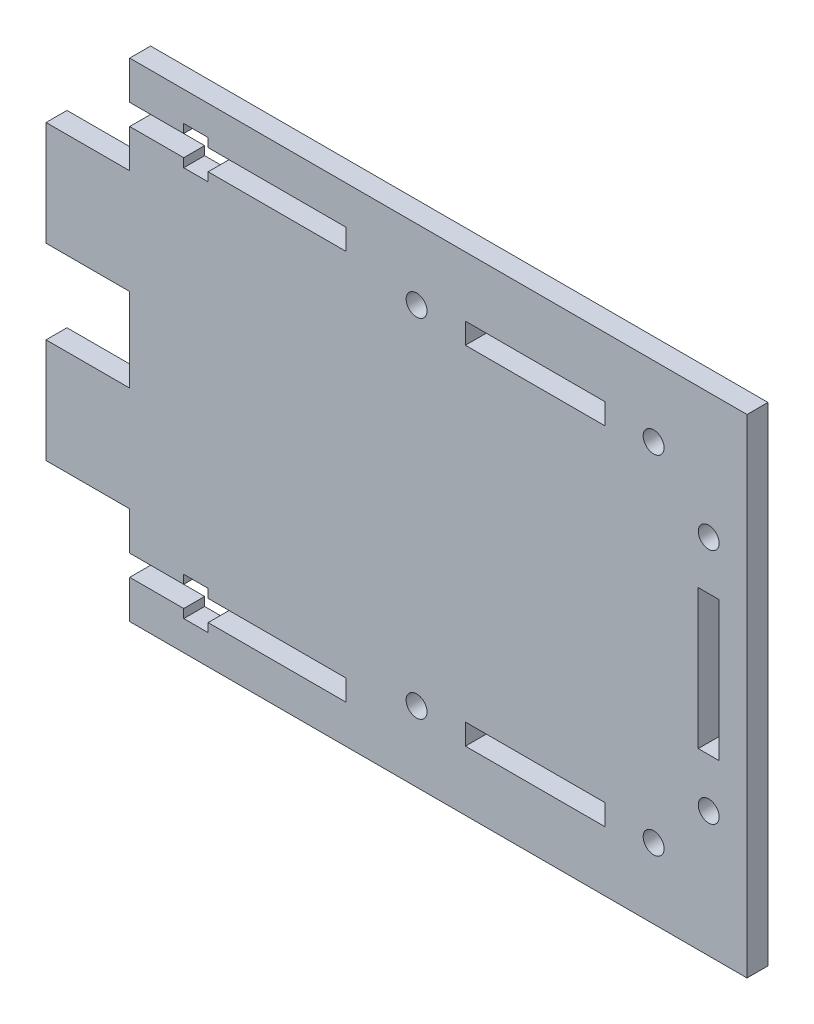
SolidWorks part; units mm, degrees
ref_plane "Front Plane" through (0, 0, 0) normal (0, 0, 1) x (1, 0, 0)
ref_plane "Top Plane" through (0, 0, 0) normal (0, 1, 0) x (1, 0, 0)
ref_plane "Right Plane" through (0, 0, 0) normal (1, 0, 0) x (0, 0, -1)
sketch "Sketch1" plane through (0, 0, 0) normal (0, 0, 1) x (1, 0, 0)
  line L0 (-1050.275, 28) -> (48949.725, 28) construction
  line L1 (-50.275, 6) -> (-38.275, 6)
  line L2 (-50.275, 6) -> (-50.275, 21)
  line L3 (-50.275, 21) -> (-38.275, 21)
  line L4 (-38.275, 6) -> (-38.275, 21)
  line L5 (-50.275, -6) -> (-38.275, -6)
  line L6 (-50.275, -6) -> (-50.275, -21)
  line L7 (-50.275, -21) -> (-38.275, -21)
  line L8 (-38.275, -6) -> (-38.275, -21)
  line L9 (-1050.275, -28) -> (48949.725, -28) construction
  line L10 (-50.275, 26.5) -> (-7.275, 26.5)
  line L11 (-50.275, 26.5) -> (-50.275, 29.5)
  line L12 (-50.275, 29.5) -> (-7.275, 29.5)
  line L13 (-7.275, 26.5) -> (-7.275, 29.5)
  line L14 (-50.275, 26.5) -> (-7.275, 29.5) construction
  line L15 (-50.275, 29.5) -> (-7.275, 26.5) construction
  line L16 (44.775, -997.1212) -> (44.775, 49002.8788) construction
  line L17 (-30.525, 25.25) -> (-27.025, 25.25)
  line L18 (-30.525, 25.25) -> (-30.525, 30.75)
  line L19 (-30.525, 30.75) -> (-27.025, 30.75)
  line L20 (-27.025, 25.25) -> (-27.025, 30.75)
  line L21 (-30.525, 25.25) -> (-27.025, 30.75) construction
  line L22 (-30.525, 30.75) -> (-27.025, 25.25) construction
  line L23 (-38.275, 35) -> (50.275, 35)
  line L24 (-38.275, 35) -> (-38.275, -35)
  line L25 (-38.275, -35) -> (50.275, -35)
  line L26 (50.275, 35) -> (50.275, -35)
  line L27 (-1050.275, 0) -> (48949.725, 0) construction
  line L28 (43.275, -10) -> (46.275, -10)
  line L29 (43.275, -10) -> (43.275, 10)
  line L30 (43.275, 10) -> (46.275, 10)
  line L31 (46.275, -10) -> (46.275, 10)
  line L32 (43.275, -10) -> (46.275, 10) construction
  line L33 (43.275, 10) -> (46.275, -10) construction
  line L34 (-30.525, -30.75) -> (-27.025, -25.25) construction
  line L35 (-30.525, -25.25) -> (-27.025, -30.75) construction
  line L36 (-50.275, -29.5) -> (-7.275, -26.5) construction
  line L37 (-50.275, -26.5) -> (-7.275, -29.5) construction
  line L38 (-27.025, -25.25) -> (-27.025, -30.75)
  line L39 (-30.525, -30.75) -> (-27.025, -30.75)
  line L40 (-30.525, -25.25) -> (-30.525, -30.75)
  line L41 (-30.525, -25.25) -> (-27.025, -25.25)
  line L42 (-7.275, -26.5) -> (-7.275, -29.5)
  line L43 (-50.275, -29.5) -> (-7.275, -29.5)
  line L44 (-50.275, -26.5) -> (-50.275, -29.5)
  line L45 (-50.275, -26.5) -> (-7.275, -26.5)
  line L46 (-983.4427, 24.9) -> (49016.5573, 24.9) construction
  line L47 (19.875, -978.85) -> (19.875, 49021.15) construction
  line L48 (9.875, -26.4) -> (29.875, -23.4) construction
  line L49 (9.875, 23.4) -> (29.875, 23.4)
  line L50 (9.875, 23.4) -> (9.875, 26.4)
  line L51 (9.875, 26.4) -> (29.875, 26.4)
  line L52 (29.875, 23.4) -> (29.875, 26.4)
  line L53 (9.875, 23.4) -> (29.875, 26.4) construction
  line L54 (9.875, 26.4) -> (29.875, 23.4) construction
  line L55 (9.875, -23.4) -> (29.875, -26.4) construction
  line L56 (29.875, -23.4) -> (29.875, -26.4)
  line L57 (9.875, -26.4) -> (29.875, -26.4)
  line L58 (9.875, -23.4) -> (9.875, -26.4)
  line L59 (9.875, -23.4) -> (29.875, -23.4)
  circle A0 centre (44.775, 17) radius 1.5
  circle A1 centre (44.775, -17) radius 1.5
  circle A2 centre (2.875, 24.9) radius 1.5
  circle A3 centre (36.875, 24.9) radius 1.5
  circle A4 centre (36.875, -24.9) radius 1.5
  circle A5 centre (2.875, -24.9) radius 1.5
  point P11 (-28.775, 28)
  point P18 (-28.775, 28)
  point P28 (44.775, 0)
  point P34 (50.275, 0)
  point P48 (-28.775, -28)
  point P52 (19.875, 24.9)
  point P70 (19.875, -24.9)
  dimension "D7" = 3
  dimension "D8" = 3
  dimension "D1" = 3
  dimension "D2" = 43
  dimension "D3" = 5.5
  dimension "D4" = 3.5
  dimension "D5" = 3
  dimension "D6" = 20
  dimension "D9" = 7
  dimension "D10" = 7
  dimension "D11" = 4
  dimension "D12" = 3
  dimension "D13" = 20
  dimension "D14" = 7
  dimension "D15" = 7
extrude "Boss-Extrude1" add sketch "Sketch1" along normal blind 3 contours L24 L45 L40 L41 L38 L42 L43 L39 L25 L26 L23 L12 L18 L19 L20 L13 L10 L17 L4 L8 A4 A3 A2 A1 A0 L52 L49 L50 L51 L31 L28 L29 | L1 L4 L3 L2 | L8 L5 L6 L7
